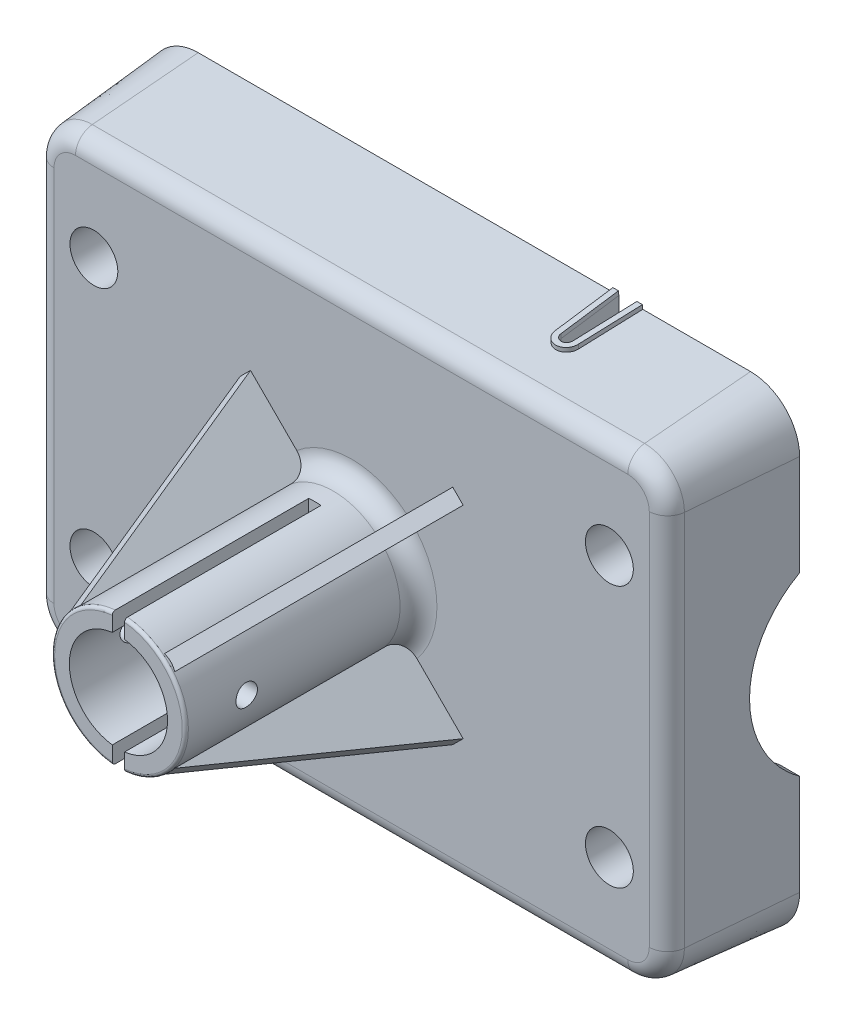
SolidWorks part; units mm, degrees
ref_plane "Plan de face" through (0, 0, 0) normal (0, 0, 1) x (1, 0, 0)
ref_plane "Plan de dessus" through (0, 0, 0) normal (0, 1, 0) x (1, 0, 0)
ref_plane "Plan de droite" through (0, 0, 0) normal (1, 0, 0) x (0, 0, -1)
sketch "Esquisse1" plane through (0, 0, 0) normal (0, 0, 1) x (1, 0, 0)
  line L1 (-45, -38.75) -> (45, -38.75)
  line L2 (-53, -30.75) -> (-53, 30.75)
  line L3 (-45, 38.75) -> (45, 38.75)
  line L4 (53, -30.75) -> (53, 30.75)
  arc A0 (-53, 30.75) -> (-45, 38.75) centre (-45, 30.75) cw
  arc A1 (45, 38.75) -> (53, 30.75) centre (45, 30.75) cw
  arc A2 (45, -38.75) -> (53, -30.75) centre (45, -30.75) ccw
  arc A3 (-45, -38.75) -> (-53, -30.75) centre (-45, -30.75) cw
  point P7 (-53, 38.75)
  point P10 (53, 38.75)
  point P15 (-53, -38.75)
  dimension "D5" = 8
  dimension "D1" = 106
  dimension "D2" = 77.5
  dimension "D3" = 38.75
  dimension "D4" = 53
extrude "Extrusion1" add sketch "Esquisse1" along normal blind 20 draft 5
fillet "Congé1" radius 3 8 edges at (0, 37.0002, 20) (49.4196, 35.1696, 20) (51.2502, 0, 20) (49.4196, -35.1696, 20) (0, -37.0002, 20) (-49.4196, -35.1696, 20) (-51.2502, 0, 20) (-49.4196, 35.1696, 20)
sketch "Esquisse2" plane through (0, 0, 0) normal (0, 0, -1) x (-1, 0, 0)
  line L0 (0, 0) -> (-57.0467, 0)
  line L1 (-57.0467, 0) -> (-57.0467, -46.669)
  line L2 (-57.0467, -46.669) -> (56.5554, -46.669)
  line L3 (56.5554, -46.669) -> (56.5554, 41.5108)
  line L4 (56.5554, 41.5108) -> (0, 41.5108)
  line L5 (0, 41.5108) -> (0, 0)
extrude "Enlèv. mat.-Extru.1" cut sketch "Esquisse2" against normal through all
shell "Coque1" thickness 3.3
sketch "Esquisse5" plane through (0, 0, 16.7) normal (0, 0, -1) x (-1, 0, 0)
  line L0 (0, 0) -> (-48.2263, 0) construction
  line L1 (-42.0666, 35.4374) -> (-40.7666, 35.4374)
  line L2 (-42.0666, 35.4374) -> (-42.0666, 22.6)
  line L4 (-40.7666, 35.4374) -> (-40.7666, 0)
  line L5 (-45, 35.4374) -> (0, 35.4374) construction
  line L6 (-42.0666, 0.65) -> (-49.6874, 0.65)
  line L7 (-49.6874, 0.65) -> (-49.6874, 0)
  line L8 (-49.6874, 0) -> (-40.7666, 0)
  line L9 (-42.0666, 8.95) -> (-49.6874, 8.95)
  line L10 (-49.6874, 8.95) -> (-49.6874, 10.25)
  line L11 (-49.6874, 10.25) -> (-42.0666, 10.25)
  line L12 (-42.0666, 21.3) -> (-49.6874, 21.3)
  line L13 (-49.6874, 21.3) -> (-49.6874, 22.6)
  line L14 (-49.6874, 22.6) -> (-42.0666, 22.6)
  line L15 (-42.0666, 21.3) -> (-42.0666, 10.25)
  line L16 (-42.0666, 8.95) -> (-42.0666, 0.65)
  dimension "D1" = 1.3
  dimension "D2" = 0.65
  dimension "D3" = 1.3
  dimension "D4" = 1.3
  dimension "D5" = 8.3
  dimension "D6" = 21.3
extrude "renforts intérieurs" add sketch "Esquisse5" along normal blind 13
sketch "Esquisse3" plane through (0, 0, 16.7) normal (0, 0, -1) x (-1, 0, 0)
  line L0 (0, 33.9763) -> (0, 0) construction
  line L1 (0, 0) -> (-40.7666, 0) construction
  circle A0 centre (-42, 21.3) radius 3.9
  dimension "D1" = 7.8
  dimension "D2" = 42
  dimension "D3" = 21.3
extrude "passage collier" cut sketch "Esquisse3" against normal mid plane 33
sketch "Esquisse4" plane through (0, 0, 16.7) normal (0, 0, -1) x (-1, 0, 0)
  circle A0 centre (-42, 21.3) radius 5.4
  circle A1 centre (-42, 21.3) radius 3.9 construction
  circle A2 centre (-42, 21.3) radius 3.9
  dimension "D1" = 10.8
extrude "bossage collier" add sketch "Esquisse4" along normal blind 13
sketch "Esquisse6" plane through (0, 0, 0) normal (-1, 0, 0) x (0, 0, 1)
  circle A0 centre (-10, 0) radius 17.5
  dimension "D1" = 10
extrude "logement tube mat" cut sketch "Esquisse6" against normal through all
sketch "Esquisse7" plane through (0, 0, 20) normal (0, 0, 1) x (1, 0, 0)
  circle A0 centre (0, 0) radius 7
  dimension "D1" = 14
extrude "passage fil" cut sketch "Esquisse7" against normal up to next
sketch "Esquisse8" plane through (0, 0, 20) normal (0, 0, 1) x (1, 0, 0)
  line L0 (0, 10.9) -> (0, 8)
  line L1 (8, 0) -> (10.9, 0)
  arc A0 (8, 0) -> (0, 8) centre (0, 0) ccw
  arc A1 (10.9, 0) -> (0, 10.9) centre (0, 0) ccw
  dimension "D1" = 16
  dimension "D2" = 21.8
extrude "centrage tube vertical" add sketch "Esquisse8" along normal blind 38
fillet "Congé2" radius 3 1 edges at (7.7075, 7.7075, 20)
ref_plane "Plan1" through (0, 0, 0) normal (0.7071, -0.7071, 0) x (0.7071, 0.7071, 0)
sketch "Esquisse9" plane through (0, 0, 0) normal (0.7071, -0.7071, 0) x (0.7071, 0.7071, 0)
  line L0 (8.3287, 64.1916) -> (24.917, 18.86)
rib "Nervure3" sketch "Esquisse9" sketch "Esquisse9" thickness 2.4 extrusion direction parallel to sketch draft on no parameters "D1"=2.4
mirror "Symétrie1"
fillet "Congé3" radius 0.5 1 edges at (0, 10.9, 58)
sketch "Esquisse10" plane through (0, 0, 58) normal (0, 0, 1) x (1, 0, 0)
  line L1 (-1, 5.402) -> (1, 5.402)
  line L2 (-1, 5.402) -> (-1, 12.4949)
  line L3 (-1, 12.4949) -> (1, 12.4949)
  line L4 (1, 5.402) -> (1, 12.4949)
  dimension "D1" = 2
  dimension "D2" = 1
extrude "fente d'élasticité" cut sketch "Esquisse10" against normal blind 32
mirror "Symétrie2"
sketch "Esquisse11" plane through (0, 0, 16.7) normal (0, 0, -1) x (-1, 0, 0)
  line L0 (-45, 38.75) -> (45, 38.75) construction
  line L1 (-17.5415, 36.5458) -> (-17.5415, 27.75)
  line L2 (-27.5415, 36.5458) -> (-27.5415, 32.4404)
  line L3 (-27.5415, 36.5458) -> (-17.5415, 36.5458)
  arc A0 (-27.5415, 32.4404) -> (-17.5415, 27.75) centre (-23.6415, 27.75) ccw
  dimension "D1" = 12.2
  dimension "D2" = 11
  dimension "D3" = 10
extrude "boucle fil" add sketch "Esquisse11" along normal blind 12.5
sketch "Esquisse12" plane through (0, 0, 4.2) normal (0, 0, -1) x (-1, 0, 0)
  line L0 (-26.3415, 35.0699) -> (-26.3415, 31.839)
  line L1 (-26.3415, 35.0699) -> (-17.5415, 35.0699)
  line L2 (-27.5415, 35.0699) -> (-27.5415, 32.4404) construction
  line L4 (-18.7415, 27.75) -> (-17.5415, 27.75)
  line L5 (-17.5415, 27.75) -> (-17.5415, 35.0699)
  arc A1 (-27.5415, 32.4404) -> (-17.5415, 27.75) centre (-23.6415, 27.75) ccw construction
  arc A2 (-26.3415, 31.839) -> (-18.7415, 27.75) centre (-23.6415, 27.75) ccw
  dimension "D2" = 1.2
  dimension "D3" = 1.2
extrude "bossage vis" cut sketch "Esquisse12" against normal blind 1
sketch "Esquisse13" plane through (0, 0, 5.2) normal (0, 0, -1) x (-1, 0, 0)
  line L0 (-26.3415, 31.839) -> (-26.3415, 35.0699)
  line L1 (-26.3415, 35.0699) -> (-26.3415, 31.839) construction
  line L3 (-23.6415, 30.25) -> (-23.6415, 35.0699)
  line L4 (-22.4415, 35.0699) -> (-22.4415, 29.9432)
  line L5 (-23.6415, 35.0699) -> (-26.3415, 35.0699)
  line L6 (-22.4415, 35.0699) -> (-18.7415, 35.0699)
  line L8 (-18.7415, 27.75) -> (-18.7415, 35.0699)
  arc A0 (-23.6415, 30.25) -> (-22.4415, 29.9432) centre (-23.6415, 27.75) ccw
  arc A1 (-26.3415, 31.839) -> (-18.7415, 27.75) centre (-23.6415, 27.75) ccw construction
  arc A2 (-26.3415, 31.839) -> (-18.7415, 27.75) centre (-23.6415, 27.75) ccw
  dimension "D1" = 5
  dimension "D2" = 1.2
extrude "passage vis 1" cut sketch "Esquisse13" against normal blind 7
sketch "Esquisse15" plane through (0, 0, 5.2) normal (0, 0, -1) x (-1, 0, 0)
  line L0 (-18.7415, 27.75) -> (-18.7415, 35.0699) construction
  line L1 (-18.7415, 27.75) -> (-17.5415, 27.75)
  line L2 (-18.7415, 27.75) -> (-18.7415, 35.0699)
  line L3 (-18.7415, 35.0699) -> (-17.5415, 35.0699)
  line L4 (-17.5415, 27.75) -> (-17.5415, 35.0699)
  line L5 (-17.5415, 27.75) -> (-17.5415, 34.9825) construction
  line L6 (-18.7415, 27.75) -> (-17.5415, 27.75) construction
  line L7 (-17.5415, 35.0699) -> (-26.3415, 35.0699) construction
extrude "Enlèv. mat.-Extru.8" cut sketch "Esquisse15" against normal blind 7
sketch "Esquisse16" plane through (0, 0, 12.2) normal (0, 0, -1) x (-1, 0, 0)
  line L0 (-23.6415, 27.75) -> (-17.0593, 27.75) construction
  line L1 (-21.1737, 28.15) -> (-18.7415, 28.15)
  line L2 (-18.7415, 28.15) -> (-18.7415, 35.0699)
  line L3 (-18.7415, 35.0699) -> (-22.4415, 35.0699)
  line L4 (-22.4415, 35.0699) -> (-22.4415, 29.9432)
  line L5 (-21.1737, 27.35) -> (-18.7579, 27.35)
  line L6 (-26.3415, 31.839) -> (-24.8502, 29.9384)
  line L7 (-26.9709, 31.3452) -> (-25.4796, 29.4446)
  line L8 (-26.3415, 31.839) -> (-26.3415, 35.0699)
  line L9 (-26.3415, 35.0699) -> (-23.6415, 35.0699)
  line L10 (-23.6415, 35.0699) -> (-23.6415, 30.25)
  line L13 (-27.6709, 24.9618) -> (-25.5787, 26.1697)
  line L14 (-28.0709, 25.6546) -> (-25.9787, 26.8625)
  line L17 (-23.3892, 25.2628) -> (-22.7639, 22.9292)
  line L18 (-22.6164, 25.4698) -> (-21.9912, 23.1363)
  arc A0 (-25.4796, 29.4446) -> (-25.9787, 26.8625) centre (-23.6415, 27.75) ccw
  arc A1 (-23.6415, 30.25) -> (-22.4415, 29.9432) centre (-23.6415, 27.75) ccw construction
  arc A2 (-26.9709, 31.3452) -> (-28.0709, 25.6546) centre (-23.6415, 27.75) ccw
  arc A3 (-26.3415, 31.839) -> (-18.7415, 27.75) centre (-23.6415, 27.75) ccw construction
  arc A4 (-25.5787, 26.1697) -> (-23.3892, 25.2628) centre (-23.6415, 27.75) ccw
  arc A5 (-23.6415, 30.25) -> (-24.8502, 29.9384) centre (-23.6415, 27.75) ccw
  arc A6 (-27.6709, 24.9618) -> (-22.7639, 22.9292) centre (-23.6415, 27.75) ccw
  arc A7 (-21.9912, 23.1363) -> (-18.7579, 27.35) centre (-23.6415, 27.75) ccw
  arc A8 (-22.6164, 25.4698) -> (-21.1737, 27.35) centre (-23.6415, 27.75) ccw
  arc A9 (-21.1737, 28.15) -> (-22.4415, 29.9432) centre (-23.6415, 27.75) ccw
  dimension "D1" = 0.4
  dimension "D2" = 0.8
  dimension "D4" = 0.8
extrude "Enlèv. mat.-Extru.9" cut sketch "Esquisse16" against normal up to surface (4.5 mm away)
sketch "Esquisse17" plane through (0, 0, 5.2) normal (0, 0, -1) x (-1, 0, 0)
  circle A0 centre (-23.6415, 27.75) radius 1
  arc A1 (-23.6415, 30.25) -> (-22.4415, 29.9432) centre (-23.6415, 27.75) ccw construction
  dimension "D1" = 2
extrude "fixation vis" cut sketch "Esquisse17" against normal blind 7
sketch "Esquisse18" plane through (0, 0, 16.7) normal (0, 0, -1) x (-1, 0, 0)
  line L0 (-45, -38.75) -> (45, -38.75) construction
  line L1 (-28.75, -30.75) -> (28.75, -30.75)
  line L2 (-31.75, -27.75) -> (-31.75, 14.25)
  line L3 (-28.75, 17.25) -> (28.75, 17.25)
  line L4 (31.75, -27.75) -> (31.75, 14.25)
  arc A0 (-31.75, 14.25) -> (-28.75, 17.25) centre (-28.75, 14.25) cw
  arc A1 (28.75, 17.25) -> (31.75, 14.25) centre (28.75, 14.25) cw
  arc A2 (28.75, -30.75) -> (31.75, -27.75) centre (28.75, -27.75) ccw
  arc A3 (-28.75, -30.75) -> (-31.75, -27.75) centre (-28.75, -27.75) cw
  point P9 (-31.75, 17.25)
  point P12 (31.75, 17.25)
  point P17 (-31.75, -30.75)
  dimension "D5" = 3
  dimension "D1" = 63.5
  dimension "D2" = 48
  dimension "D3" = 31.75
  dimension "D4" = 8
extrude "bossage couvercle" add sketch "Esquisse18" along normal blind 3.8
sketch "Esquisse19" plane through (0, 0, 12.9) normal (0, 0, -1) x (-1, 0, 0)
  line L9 (-30.45, 14.25) -> (-30.45, -27.75)
  line L10 (-28.75, -29.45) -> (28.75, -29.45)
  line L11 (30.45, -27.75) -> (30.45, 14.25)
  line L12 (28.75, 15.95) -> (-28.75, 15.95)
  line L13 (-30.45, 14.25) -> (-30.45, -27.75)
  line L14 (-28.75, -29.45) -> (28.75, -29.45)
  line L15 (30.45, -27.75) -> (30.45, 14.25)
  line L16 (28.75, 15.95) -> (-28.75, 15.95)
  arc A8 (-28.75, 15.95) -> (-30.45, 14.25) centre (-28.75, 14.25) ccw
  arc A9 (-30.45, -27.75) -> (-28.75, -29.45) centre (-28.75, -27.75) ccw
  arc A10 (28.75, -29.45) -> (30.45, -27.75) centre (28.75, -27.75) ccw
  arc A11 (30.45, 14.25) -> (28.75, 15.95) centre (28.75, 14.25) ccw
  arc A12 (-28.75, 15.95) -> (-30.45, 14.25) centre (-28.75, 14.25) ccw
  arc A13 (-30.45, -27.75) -> (-28.75, -29.45) centre (-28.75, -27.75) ccw
  arc A14 (28.75, -29.45) -> (30.45, -27.75) centre (28.75, -27.75) ccw
  arc A15 (30.45, 14.25) -> (28.75, 15.95) centre (28.75, 14.25) ccw
  dimension "D1" = 1.3
extrude "joint ext" cut sketch "Esquisse19" against normal blind 3.8
sketch "Esquisse20" plane through (0, 0, 16.7) normal (0, 0, -1) x (-1, 0, 0)
  line L8 (-29.15, 14.25) -> (-29.15, -27.75)
  line L9 (-28.75, -28.15) -> (28.75, -28.15)
  line L10 (29.15, -27.75) -> (29.15, 14.25)
  line L11 (28.75, 14.65) -> (-28.75, 14.65)
  line L12 (-29.15, 14.25) -> (-29.15, -27.75)
  line L13 (-28.75, -28.15) -> (28.75, -28.15)
  line L14 (29.15, -27.75) -> (29.15, 14.25)
  line L15 (28.75, 14.65) -> (-28.75, 14.65)
  arc A8 (-28.75, 14.65) -> (-29.15, 14.25) centre (-28.75, 14.25) ccw
  arc A9 (-29.15, -27.75) -> (-28.75, -28.15) centre (-28.75, -27.75) ccw
  arc A10 (28.75, -28.15) -> (29.15, -27.75) centre (28.75, -27.75) ccw
  arc A11 (29.15, 14.25) -> (28.75, 14.65) centre (28.75, 14.25) ccw
  arc A12 (-28.75, 14.65) -> (-29.15, 14.25) centre (-28.75, 14.25) ccw
  arc A13 (-29.15, -27.75) -> (-28.75, -28.15) centre (-28.75, -27.75) ccw
  arc A14 (28.75, -28.15) -> (29.15, -27.75) centre (28.75, -27.75) ccw
  arc A15 (29.15, 14.25) -> (28.75, 14.65) centre (28.75, 14.25) ccw
  dimension "D1" = 1.3
extrude "joint int" add sketch "Esquisse20" along normal blind 1.7
sketch "Esquisse21" plane through (0, 0, 15) normal (0, 0, -1) x (-1, 0, 0)
  line L8 (-27.85, 13.35) -> (-27.85, -26.85)
  line L9 (-27.85, -26.85) -> (27.85, -26.85)
  line L10 (27.85, -26.85) -> (27.85, 13.35)
  line L11 (27.85, 13.35) -> (-27.85, 13.35)
  line L12 (-27.85, 13.35) -> (-27.85, -26.85)
  line L13 (-27.85, -26.85) -> (27.85, -26.85)
  line L14 (27.85, -26.85) -> (27.85, 13.35)
  line L15 (27.85, 13.35) -> (-27.85, 13.35)
  dimension "D1" = 1.3
extrude "evidement ci" cut sketch "Esquisse21" against normal blind 1.7
sketch "Esquisse22" plane through (0, 0, 16.7) normal (0, 0, -1) x (-1, 0, 0)
  line L0 (28.75, 17.25) -> (-28.75, 17.25) construction
  line L1 (-3.25, 17.25) -> (-2.25, 17.25)
  line L2 (-3.25, 17.25) -> (-3.25, 21.25)
  line L3 (-2.25, 20.25) -> (12.35, 20.25)
  line L4 (13.35, 17.25) -> (13.35, 21.25)
  line L5 (31.75, -27.75) -> (31.75, 14.25) construction
  line L6 (12.35, 17.25) -> (13.35, 17.25)
  line L7 (-3.25, 21.25) -> (13.35, 21.25)
  line L8 (-2.25, 17.25) -> (-2.25, 20.25)
  line L10 (12.35, 17.25) -> (12.35, 20.25)
  dimension "D1" = 35
  dimension "D2" = 16.6
  dimension "D3" = 4
  dimension "D5" = 1
  dimension "D6" = 1
extrude "logement joint" add sketch "Esquisse22" along normal up to surface (3.8 mm away)
sketch "Esquisse23" plane through (0, 21.25, 0) normal (0, 1, 0) x (-1, 0, 0)
  line L0 (-3.25, 12.9) -> (13.35, 12.9) construction
  line L1 (2.75, 12.9) -> (7.35, 12.9)
  line L2 (2.75, 12.9) -> (2.75, 16.7)
  line L3 (2.75, 16.7) -> (7.35, 16.7)
  line L4 (7.35, 12.9) -> (7.35, 16.7)
  line L5 (13.35, 16.7) -> (-3.25, 16.7) construction
  line L6 (-3.25, 12.9) -> (-3.25, 16.7) construction
  line L7 (13.35, 12.9) -> (13.35, 16.7) construction
  point P11 (-3.25, 14.8)
  dimension "D1" = 6
  dimension "D2" = 6
extrude "passge fil" cut sketch "Esquisse23" against normal blind 11.7
sketch "Esquisse24" plane through (0, 0, 16.7) normal (0, 0, -1) x (-1, 0, 0)
  line L1 (-30.45, 14.25) -> (-30.45, -27.75) construction
  line L2 (2.75, 15.95) -> (-28.75, 15.95) construction
  line L4 (-28.75, -29.45) -> (28.75, -29.45) construction
  circle A0 centre (-16, 18.45) radius 1.75
  circle A1 centre (-32.95, 6.75) radius 1.75
  circle A2 centre (-32.95, -20.25) radius 1.75
  circle A3 centre (-16, -31.95) radius 1.75
  dimension "D1" = 3.5
  dimension "D2" = 2.5
  dimension "D3" = 2.5
  dimension "D4" = 2.5
  dimension "D5" = 27
  dimension "D7" = 16
  dimension "D8" = 2.5
extrude "bossage fixation couvercle" add sketch "Esquisse24" along normal up to surface (3.8 mm away)
sketch "Esquisse25" plane through (0, 0, 12.9) normal (0, 0, -1) x (-1, 0, 0)
  circle A0 centre (-16, 18.45) radius 1
  circle A1 centre (-32.95, 6.75) radius 1
  circle A2 centre (-32.95, -20.25) radius 1
  circle A3 centre (-16, -31.95) radius 1
  arc A4 (-14.7262, 17.25) -> (-17.2738, 17.25) centre (-16, 18.45) ccw construction
  arc A5 (-31.75, 8.0238) -> (-31.75, 5.4762) centre (-32.95, 6.75) ccw construction
  arc A6 (-31.75, -18.9762) -> (-31.75, -21.5238) centre (-32.95, -20.25) ccw construction
  arc A7 (-17.2738, -30.75) -> (-14.7262, -30.75) centre (-16, -31.95) ccw construction
  dimension "D1" = 2
extrude "4 vis fixation couvercle" cut sketch "Esquisse25" against normal blind 5
mirror "Symétrie3 fixation couvercle" about plane through (0, 0, 0) normal (1, 0, 0) of "bossage fixation couvercle", "4 vis fixation couvercle"
ref_plane "Plan2" through (0, 38.75, 0) normal (0, 1, 0) x (-1, 0, 0)
sketch "Esquisse26" plane through (0, 38.75, 0) normal (0, 1, 0) x (-1, 0, 0)
  line L0 (-26.5415, 0) -> (-26.0402, 9.9014)
  line L1 (-24.0428, 9.9014) -> (-23.5415, 0)
  line L2 (-45, 0) -> (45, 0) construction
  line L3 (-26.5415, 0) -> (-23.5415, 0)
  line L4 (-25.0415, 9.8508) -> (-25.0415, -5.3048) construction
  arc A0 (-24.0428, 9.9014) -> (-26.0402, 9.9014) centre (-25.0415, 9.8508) ccw
  dimension "D2" = 2
  dimension "D1" = 1.5
  dimension "D3" = 1.5
  dimension "D4" = 0.1
extrude "passage fil extérieur" cut sketch "Esquisse26" against normal blind 8
sketch "Esquisse27" plane through (0, 38.4557, 3.3644) normal (0, 0.9962, 0.0872) x (-1, 0, 0)
  line L0 (-27.4427, -3.3773) -> (-26.9391, 6.6068)
  line L1 (-22.6404, -3.3773) -> (-23.1439, 6.6068)
  line L2 (-26.5415, -3.3773) -> (-26.0402, 6.5619) construction
  line L3 (-24.0428, 6.5619) -> (-23.5415, -3.3773) construction
  line L4 (-27.4427, -3.3773) -> (-26.5415, -3.3773)
  line L5 (-26.5415, -3.3773) -> (-26.0403, 6.5615)
  line L6 (-23.5415, -3.3773) -> (-24.0428, 6.5615)
  line L7 (-23.5415, -3.3773) -> (-22.6404, -3.3773)
  line L8 (-45, -3.3773) -> (-26.5415, -3.3773) construction
  line L9 (-23.5415, -3.3773) -> (45, -3.3773) construction
  arc A0 (-23.1439, 6.6068) -> (-26.9391, 6.6068) centre (-25.0415, 6.5111) ccw
  arc A1 (-24.0428, 6.5615) -> (-26.0403, 6.5615) centre (-25.0415, 6.5111) ccw
  ellipse E0 centre (-25.0415, 6.5111) end of major axis (-25.0415, 5.5073) minor radius 1 (-24.0428, 6.5619) -> (-26.0402, 6.5619) ccw construction
  dimension "D1" = 0.9
  dimension "D2" = 0.9
extrude "renfort" add sketch "Esquisse27" along normal blind 0.7
sketch "Esquisse28" plane through (0, 0, 0) normal (1, 0, 0) x (0, 0, -1)
  line L0 (-58, 10.9) -> (-58, -10.9) construction
  circle A0 centre (-48, 0) radius 1.75
  point P2 (-58, 0)
  dimension "D1" = 3.5
  dimension "D2" = 10
extrude "passage vis" cut sketch "Esquisse28" against normal mid plane 30.7
sketch "Esquisse29" plane through (0, 0, 16.7) normal (0, 0, -1) x (-1, 0, 0)
  line L0 (-3.25, 21.25) -> (2.75, 21.25) construction
  line L1 (2.75, 20.25) -> (2.75, 21.25) construction
  line L2 (7.35, 20.25) -> (7.35, 21.25) construction
  line L4 (-5.25, 23.25) -> (-1.368, 23.25)
  line L5 (-5.25, 23.25) -> (-5.25, 25.25)
  line L6 (-5.25, 25.25) -> (-1.368, 25.25)
  line L8 (11.468, 23.25) -> (15.35, 23.25)
  line L10 (11.468, 25.25) -> (15.35, 25.25)
  line L11 (15.35, 23.25) -> (15.35, 25.25)
  arc A0 (-1.368, 23.25) -> (-1.368, 25.25) centre (-0.25, 24.25) ccw
  arc A1 (11.468, 25.25) -> (11.468, 23.25) centre (10.35, 24.25) ccw
  point P6 (2.75, 20.75)
  point P9 (7.35, 20.75)
  dimension "D4" = 3
  dimension "D1" = 3
  dimension "D2" = 3
  dimension "D3" = 3
  dimension "D5" = 1
  dimension "D6" = 2
  dimension "D7" = 5
  dimension "D8" = 5
extrude "Extrusion2" add sketch "Esquisse29" along normal up to surface (3.8 mm away)
sketch "Esquisse30" plane through (0, 0, 12.9) normal (0, 0, -1) x (-1, 0, 0)
  circle A0 centre (-4.25, 24.25) radius 0.75
  circle A1 centre (14.35, 24.25) radius 0.75
  dimension "D1" = 1.5
  dimension "D2" = 4
  dimension "D3" = 4
extrude "Extrusion3" add sketch "Esquisse30" along normal blind 1
sketch "Esquisse31" plane through (0, 0, 12.9) normal (0, 0, -1) x (-1, 0, 0)
  circle A0 centre (-0.25, 24.25) radius 0.75
  circle A1 centre (10.35, 24.25) radius 0.75
  arc A2 (-1.368, 23.25) -> (-1.368, 25.25) centre (-0.25, 24.25) ccw construction
  arc A3 (11.468, 25.25) -> (11.468, 23.25) centre (10.35, 24.25) ccw construction
  dimension "D1" = 1.5
extrude "Enlèv. mat.-Extru.10" cut sketch "Esquisse31" against normal blind 5
